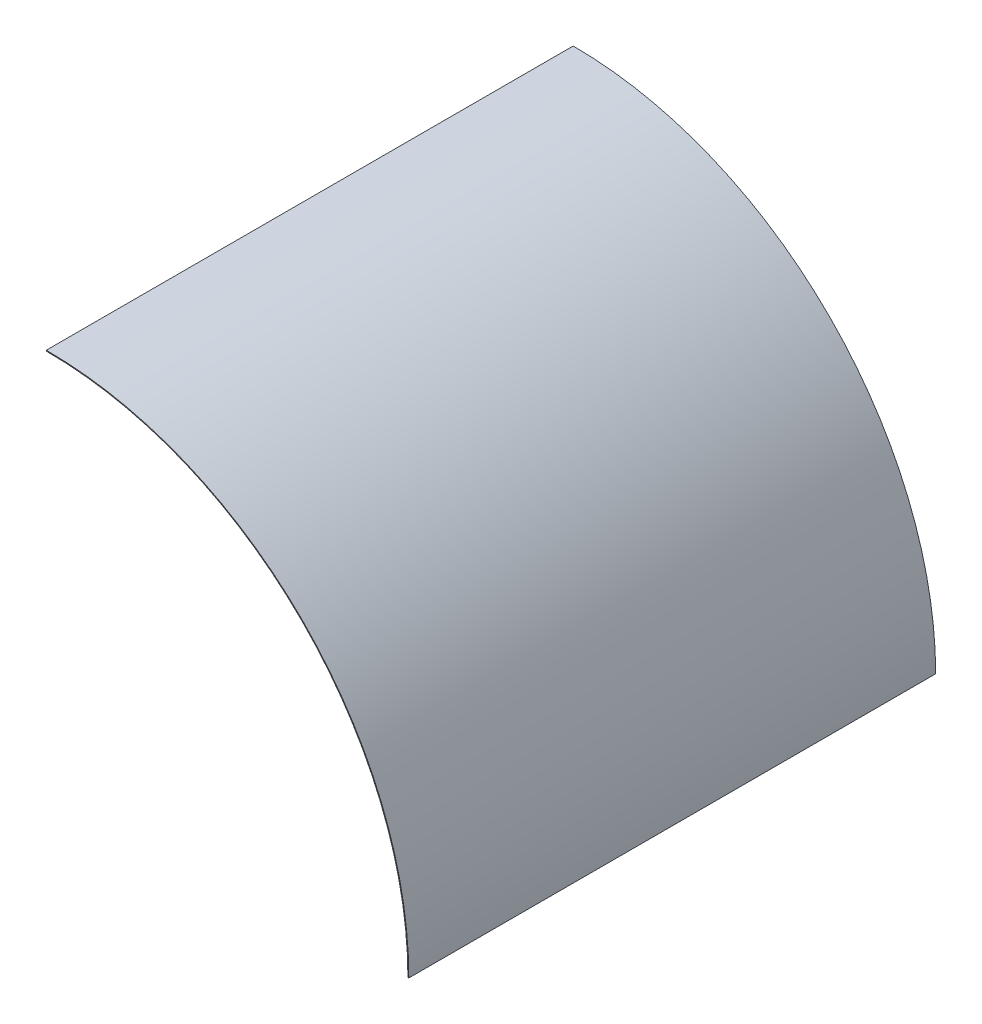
SolidWorks part; units mm, degrees
ref_plane "Front Plane" through (0, 0, 0) normal (0, 0, 1) x (1, 0, 0)
ref_plane "Top Plane" through (0, 0, 0) normal (0, 1, 0) x (1, 0, 0)
ref_plane "Right Plane" through (0, 0, 0) normal (1, 0, 0) x (0, 0, -1)
sketch "Sketch1" plane through (0, 0, 0) normal (0, 0, 1) x (1, 0, 0)
  line L0 (0, 0) -> (0, 45.174) construction
  line L1 (0, 0) -> (40.8023, 0) construction
  line L2 (0, 2064) -> (0, 2059)
  line L3 (2064, 0) -> (2059, 0)
  arc A0 (0, 2059) -> (2059, 0) centre (0, 0) cw
  arc A1 (0, 2064) -> (2064, 0) centre (0, 0) cw
  dimension "D1" = 2059
  dimension "D2" = 5
extrude "Boss-Extrude1" add sketch "Sketch1" against normal blind 3000
